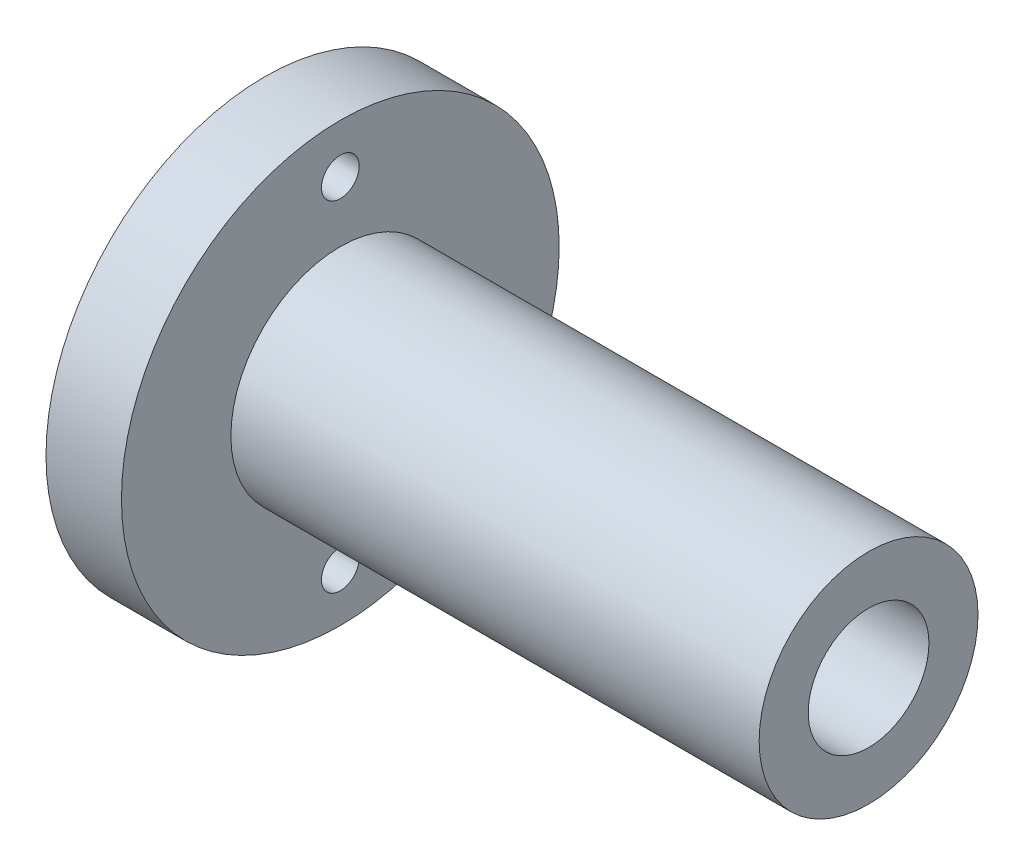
SolidWorks part; units mm, degrees
ref_plane "Front Plane" through (0, 0, 0) normal (0, 0, 1) x (1, 0, 0)
ref_plane "Top Plane" through (0, 0, 0) normal (0, 1, 0) x (1, 0, 0)
ref_plane "Right Plane" through (0, 0, 0) normal (1, 0, 0) x (0, 0, -1)
sketch "Sketch1" plane through (0, 0, 0) normal (1, 0, 0) x (0, 0, -1)
  circle A0 centre (0, 0) radius 14.5
  dimension "D1" = 29
extrude "Boss-Extrude1" add sketch "Sketch1" along normal blind 70
sketch "Sketch2" plane through (0, 0, 0) normal (-1, 0, 0) x (0, 0, 1)
  circle A0 centre (0, 0) radius 29
  dimension "D1" = 58
extrude "Boss-Extrude2" add sketch "Sketch2" along normal blind 10
sketch "Sketch3" plane through (-10, 0, 0) normal (-1, 0, 0) x (0, 0, 1)
  circle A0 centre (0, 0) radius 13
  dimension "D1" = 26
extrude "Cut-Extrude1" cut sketch "Sketch3" against normal blind 48
sketch "Sketch4" plane through (70, 0, 0) normal (1, 0, 0) x (0, 0, -1)
  circle A0 centre (0, 0) radius 8
  dimension "D1" = 16
extrude "Cut-Extrude2" cut sketch "Sketch4" against normal up to next
chamfer "Chamfer1" distance 4 angle 45 1 edges at (-10, 0, 13)
sketch "Sketch5" plane through (-10, 0, 0) normal (-1, 0, 0) x (0, 0, 1)
  line L0 (0, 0) -> (26.2672, 0) construction
  circle A0 centre (0, 22.5) radius 2.5
  circle A1 centre (0, -22.5) radius 2.5
  dimension "D1" = 5
  dimension "D2" = 45
extrude "Cut-Extrude3" cut sketch "Sketch5" against normal up to next
